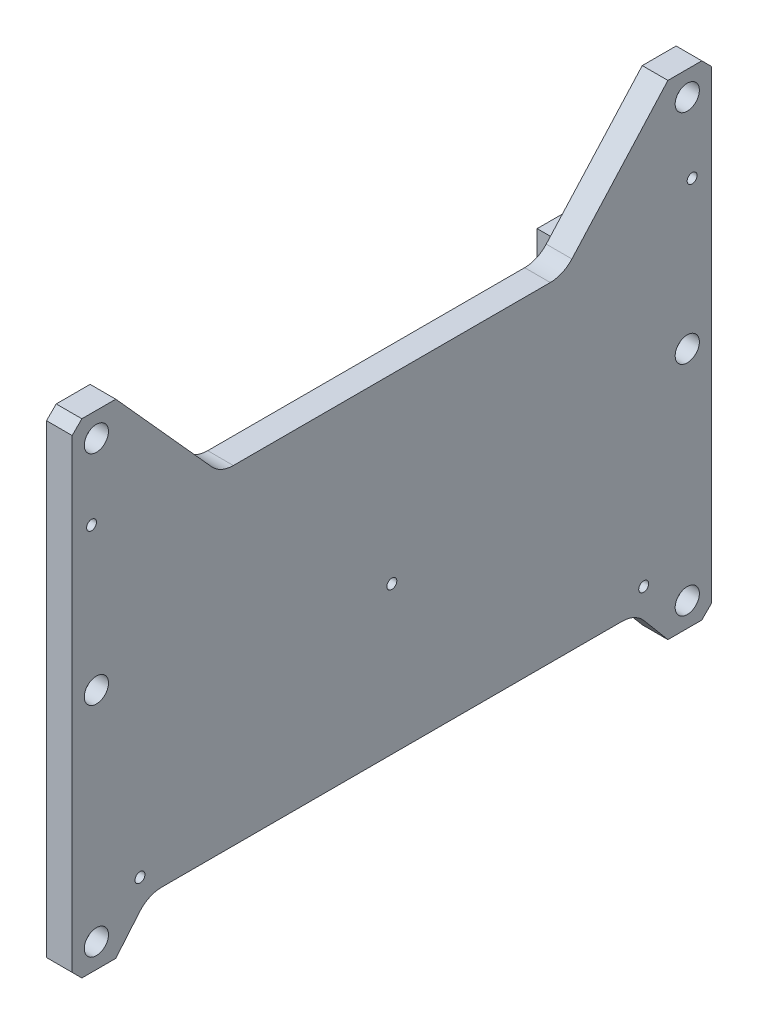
SolidWorks part; units mm, degrees
ref_plane "Спереди" through (0, 0, 0) normal (0, 0, 1) x (1, 0, 0)
ref_plane "Сверху" through (0, 0, 0) normal (0, 1, 0) x (1, 0, 0)
ref_plane "Справа" through (0, 0, 0) normal (1, 0, 0) x (0, 0, -1)
sketch "Эскиз1" plane through (0, 0, 0) normal (-1, 0, 0) x (0, 0, 1)
  line L0 (0, 43.75) -> (0, -53.5714) construction
  line L1 (-80.506, 0) -> (73.9583, 0) construction
  line L2 (-66, 50) -> (-57, 50)
  line L3 (-66, 50) -> (-66, -50)
  line L4 (-66, -50) -> (-57, -50)
  line L5 (66, 50) -> (66, -50)
  line L6 (-57, 50) -> (-35.3903, 26)
  line L7 (-35.3903, 26) -> (35.3903, 26)
  line L8 (57, 50) -> (35.3903, 26)
  line L9 (-57, -50) -> (-50.2872, -42)
  line L10 (-50.2872, -42) -> (50.2872, -42)
  line L11 (57, -50) -> (50.2872, -42)
  line L12 (57, 50) -> (66, 50)
  line L13 (57, -50) -> (66, -50)
  point P14 (0, 26)
  point P19 (0, -42)
  dimension "D1" = 100
  dimension "D2" = 132
  dimension "D3" = 76
  dimension "D4" = 132
  dimension "D5" = 9
  dimension "D6" = 8
  dimension "D7" = 130
  dimension "D8" = 9
extrude "Бобышка-Вытянуть1" add sketch "Эскиз1" along normal blind 5.3
chamfer "Фаска1" distance 2 angle 45 4 edges at (-2.65, 50, 66) (-2.65, -50, 66) (-2.65, -50, -66) (-2.65, 50, -66)
fillet "Скругление1" radius 6 4 edges at (-2.65, -42, 50.2872) (-2.65, -42, -50.2872) (-2.65, 26, -35.3903) (-2.65, 26, 35.3903)
sketch "Эскиз2" plane through (-5.3, 0, 0) normal (-1, 0, 0) x (0, 0, 1)
  line L0 (-64, -50) -> (-57, -50) construction
  line L1 (-60, 27) -> (-40, 27)
  line L2 (-60, 27) -> (-60, 11)
  line L3 (-60, 11) -> (-40, 11)
  line L4 (-40, 27) -> (-40, 11)
  line L5 (-66, 48) -> (-66, -48) construction
  dimension "D1" = 77
  dimension "D2" = 6
  dimension "D3" = 26
  dimension "D4" = 61
extrude "Бобышка-Вытянуть2" add sketch "Эскиз2" along normal blind 4.7
sketch "Эскиз3" plane through (-5.3, 0, 0) normal (-1, 0, 0) x (0, 0, 1)
  line L0 (-66, 48) -> (-66, -48) construction
  line L1 (-34, 4) -> (-15, 4)
  line L2 (-51, 4) -> (-51, -33)
  line L3 (-51, -33) -> (-15, -33)
  line L4 (-15, 4) -> (-15, -33)
  line L5 (-64, -50) -> (-57, -50) construction
  line L6 (-40, 11) -> (-40, 10)
  line L7 (-51, 4) -> (-51, 5)
  line L8 (-60, 11) -> (-57, 11)
  line L9 (-60, 11) -> (-40, 11)
  arc A0 (-40, 10) -> (-34, 4) centre (-34, 10) ccw
  arc A1 (-57, 11) -> (-51, 5) centre (-57, 5) cw
  dimension "D5" = 6
  dimension "D6" = 6
  dimension "D1" = 15
  dimension "D2" = 51
  dimension "D3" = 17
  dimension "D4" = 54
extrude "Бобышка-Вытянуть3" add sketch "Эскиз3" along normal blind 3.8 contours A1 L7 L2 L3 L4 L1 A0 L6 M25
sketch "Эскиз4" plane through (-5.3, 0, 0) normal (-1, 0, 0) x (0, 0, 1)
  line L0 (-66, 48) -> (-66, -48) construction
  line L1 (18, -8) -> (55, -8)
  line L2 (18, -8) -> (18, -34)
  line L3 (18, -34) -> (55, -34)
  line L4 (55, -8) -> (55, -34)
  line L5 (57, -50) -> (64, -50) construction
  dimension "D1" = 84
  dimension "D2" = 121
  dimension "D3" = 16
  dimension "D4" = 42
extrude "Вырез-Вытянуть1" cut sketch "Эскиз4" against normal blind 3.9
fillet "Скругление2" radius 3 4 edges at (-3.35, -34, 55) (-3.35, -8, 55) (-3.35, -34, 18) (-3.35, -8, 18)
hole_wizard "Отверстие обработанное метчиком M41" positions "Эскиз5" profile "Эскиз6" tap size "M4" standard "GOST"
sketch "Эскиз5" plane through (0, 0, 0) normal (1, 0, 0) x (0, 0, -1)
  line L0 (-66, -48) -> (-66, 48) construction
  line L1 (-57, -50) -> (-64, -50) construction
  line L2 (66, 48) -> (66, -48) construction
  point P0 (-61, 45)
  point P2 (61, 45)
  point P4 (61, -45)
  point P6 (-61, -45)
  point P16 (-61, 0)
  point P18 (61, 0)
  dimension "D1" = 5
  dimension "D2" = 5
  dimension "D3" = 50
  dimension "D4" = 95
  dimension "D5" = 5
sketch "Эскиз6" plane through (0, 45, 61) normal (0, 1, 0) x (0, 0, -1)
  line L0 (0, 0) -> (0, 10)
  line L1 (0, 10) -> (1.65, 10)
  line L2 (1.65, 10) -> (1.65, 0)
  line L5 (1.65, 0) -> (0, 0)
  line L11 (0, -6.35) -> (0, 107.95) construction
  dimension "Диаметр проходного сверла" = 3.3
  dimension "Глубина проходного сверла" = 10
hole_wizard "CBORE for M4 Cheese Head Screw 14912" positions "Эскиз7" profile "Эскиз8" counterbore size "M4" standard "GOST"
sketch "Эскиз7" plane through (0, 0, 0) normal (1, 0, 0) x (0, 0, -1)
  point P0 (-61, 45)
  point P3 (-61, 0)
  point P6 (-61, -45)
  point P9 (61, -45)
  point P12 (61, 0)
  point P15 (61, 45)
sketch "Эскиз8" plane through (0, 45, 61) normal (0, 1, 0) x (0, 0, -1)
  line L0 (0, 0) -> (0, 10)
  line L1 (0, 10) -> (1.5, 10)
  line L3 (1.5, 10) -> (1.5, 3.5)
  line L4 (1.5, 3.5) -> (2.5, 3.5)
  line L5 (2.5, 3.5) -> (2.5, 0)
  line L7 (2.5, 0) -> (0, 0)
  line L11 (0, -6.35) -> (0, 107.95) construction
  dimension "Диаметр сквозного отверстия" = 3
  dimension "Глубина сквозного отверстия" = 10
  dimension "Диаметр цековки" = 5
  dimension "Глубина цековки" = 3.5
hole_wizard "Отверстие обработанное метчиком M2,51" positions "Эскиз9" profile "Эскиз10" tap size "M2,5" standard "GOST"
sketch "Эскиз9" plane through (-5.3, 0, 0) normal (-1, 0, 0) x (0, 0, 1)
  line L1 (-64, -50) -> (-57, -50) construction
  line L3 (-66, 48) -> (-66, -48) construction
  line L4 (66, -48) -> (66, 48) construction
  point P0 (-62, 30)
  point P2 (62, 30)
  point P4 (-52, -38)
  point P6 (52, -38)
  point P8 (0, -11.5)
  point P21 (0, 0)
  point P22 (0, 0)
  dimension "D1" = 80
  dimension "D2" = 12
  dimension "D3" = 38.5
  dimension "D4" = 4
  dimension "D5" = 14
  dimension "D6" = 66
  dimension "D7" = 4
  dimension "D8" = 14
sketch "Эскиз10" plane through (-5.3, 30, -62) normal (0, 1, 0) x (0, 0, 1)
  line L0 (0, 0) -> (0, 5.3)
  line L1 (0, 5.3) -> (1.025, 5.3)
  line L2 (1.025, 5.3) -> (1.025, 0)
  line L5 (1.025, 0) -> (0, 0)
  line L11 (0, -6.35) -> (0, 107.95) construction
  dimension "Диаметр проходного сверла" = 2.05
  dimension "Глубина проходного сверла" = 5.3
hole_wizard "CBORE for M2,5 Cheese Head Screw 14911" positions "Эскиз11" profile "Эскиз12" counterbore size "M2,5" standard "GOST"
sketch "Эскиз11" plane through (-5.3, 0, 0) normal (-1, 0, 0) x (0, 0, 1)
  point P0 (-62, 30)
  point P3 (0, -11.5)
  point P6 (62, 30)
  point P9 (52, -38)
  point P12 (-52, -38)
sketch "Эскиз12" plane through (-5.3, 30, -62) normal (0, 1, 0) x (0, 0, 1)
  line L0 (0, 0) -> (0, 5.3)
  line L1 (0, 5.3) -> (1, 5.3)
  line L3 (1, 5.3) -> (1, 0.5)
  line L4 (1, 0.5) -> (2.6, 0.5)
  line L5 (2.6, 0.5) -> (2.6, 0)
  line L7 (2.6, 0) -> (0, 0)
  line L11 (0, -6.35) -> (0, 107.95) construction
  dimension "Диаметр сквозного отверстия" = 2
  dimension "Глубина сквозного отверстия" = 5.3
  dimension "Диаметр цековки" = 5.2
  dimension "Глубина цековки" = 0.5
